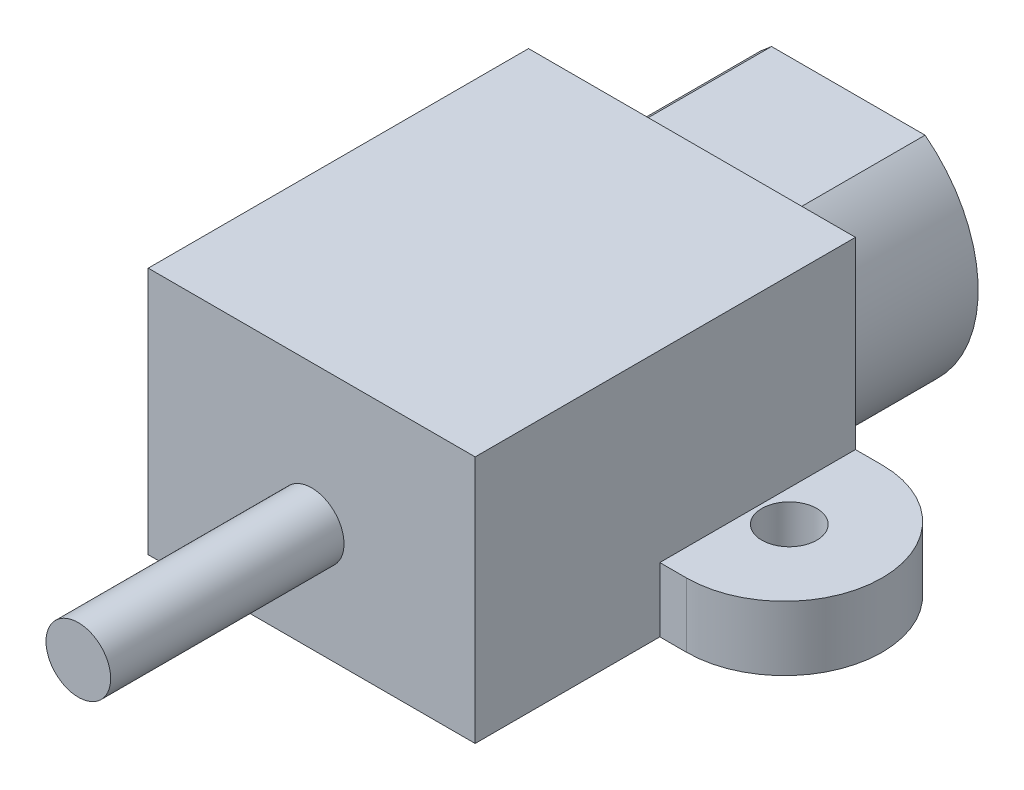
SolidWorks part; units mm, degrees
ref_plane "Front Plane" through (0, 0, 0) normal (0, 0, 1) x (1, 0, 0)
ref_plane "Top Plane" through (0, 0, 0) normal (0, 1, 0) x (1, 0, 0)
ref_plane "Right Plane" through (0, 0, 0) normal (1, 0, 0) x (0, 0, -1)
sketch "Sketch1" plane through (0, 0, 0) normal (0, 1, 0) x (1, 0, 0)
  line L0 (-1.2319, 8.5217) -> (16.3195, 8.5217) construction
  line L1 (0, 0) -> (15.0876, 0)
  line L2 (15.0876, 0) -> (15.0876, 8.5217)
  line L3 (-1.2319, 17.5514) -> (16.3195, 17.5514)
  line L4 (0, 0) -> (0, 8.5217)
  line L5 (16.3195, 8.5217) -> (15.0876, 8.5217)
  line L6 (0, 8.5217) -> (-1.2319, 8.5217)
  arc A0 (-1.2319, 17.5514) -> (-1.2319, 8.5217) centre (-1.2319, 13.0365) ccw
  arc A1 (16.3195, 17.5514) -> (16.3195, 8.5217) centre (16.3195, 13.0365) cw
  point P13 (20.8344, 13.0365)
  point P14 (-5.7468, 13.0365)
  point P17 (7.5438, 0)
  point P18 (7.5438, 8.5217)
  dimension "D1" = 17.5514
  dimension "D2" = 9.0297
  dimension "D3" = 26.5811
  dimension "D4" = 15.0876
extrude "Boss-Extrude1" add sketch "Sketch1" along normal blind 2.9718
sketch "Sketch2" plane through (0, 2.9718, 0) normal (0, 1, 0) x (1, 0, 0)
  line L0 (15.0876, 0) -> (15.0876, 8.5217) construction
  line L1 (0, 0) -> (15.0876, 0)
  line L2 (0, 0) -> (0, 17.5514)
  line L3 (0, 17.5514) -> (15.0876, 17.5514)
  line L4 (15.0876, 0) -> (15.0876, 17.5514)
  line L5 (16.3195, 17.5514) -> (-1.2319, 17.5514) construction
  point P6 (14.5462, 14.5462)
extrude "Boss-Extrude2" add sketch "Sketch2" along normal offset from surface (8.4836 mm away) 11.4554
sketch "Sketch3" plane through (0, 0, -17.5514) normal (0, 0, -1) x (-1, 0, 0)
  line L1 (-16.3195, 0) -> (1.2319, 0) construction
  line L2 (-13.4874, 0) -> (-1.6002, 0) construction
  line L3 (-13.4874, 0) -> (-13.4874, 9.906) construction
  line L4 (-13.4874, 9.906) -> (-1.6002, 9.906) construction
  line L5 (-1.6002, 0) -> (-1.6002, 9.906) construction
  line L6 (-13.4874, 0) -> (-1.6002, 9.906) construction
  line L7 (-13.4874, 9.906) -> (-1.6002, 0) construction
  circle A0 centre (-7.5438, 4.953) radius 1.4922
  point P2 (-7.5438, 6.4453)
  point P7 (-7.5438, 4.953)
  point P8 (-7.5438, 0)
  point P11 (0, 0)
  dimension "D3" = 2.9845
  dimension "D1" = 9.906
  dimension "D2" = 11.8872
extrude "Boss-Extrude3" add sketch "Sketch3" against normal offset from surface (28.321 mm away) 10.7696
sketch "Sketch4" plane through (0, 0, 0) normal (0, -1, 0) x (1, 0, 0)
  line L0 (17.8181, -13.0365) -> (-2.7305, -13.0365) construction
  line L1 (16.3195, -17.5514) -> (-1.2319, -17.5514) construction
  circle A0 centre (16.5481, -13.0365) radius 1.27
  circle A1 centre (-1.4605, -13.0365) radius 1.27
  arc A4 (16.3195, -17.5514) -> (16.3195, -8.5217) centre (16.3195, -13.0365) ccw construction
  point P6 (7.5438, -13.0365)
  point P9 (7.5438, -17.5514)
  point P13 (20.8344, -13.0365)
  dimension "D1" = 2.54
  dimension "D2" = 20.5486
extrude "Cut-Extrude1" cut sketch "Sketch4" against normal through all
sketch "Sketch5" plane through (0, 0, -17.5514) normal (0, 0, -1) x (-1, 0, 0)
  line L0 (-16.3195, 0) -> (1.2319, 0) construction
  line L1 (-11.0871, 9.9314) -> (-4.0005, 9.9314)
  line L2 (-4.0005, 0) -> (-11.0871, 0)
  line L3 (-13.5382, 4.9657) -> (-1.5494, 4.9657) construction
  line L4 (-11.0871, 9.9314) -> (-13.5382, 9.9314) construction
  line L5 (-13.5382, 9.9314) -> (-13.5382, 4.9657) construction
  line L6 (-1.5494, 4.9657) -> (-1.5494, 9.9314) construction
  line L7 (-1.5494, 9.9314) -> (-4.0005, 9.9314) construction
  line L8 (-4.0005, 9.9314) -> (-3.9689, 9.9242) construction
  line L9 (-13.5382, 4.9657) -> (-13.5382, 0) construction
  line L10 (-13.5382, 0) -> (-11.0871, 0) construction
  line L11 (-11.0871, 0) -> (-11.1199, -0.0263) construction
  line L12 (-4.0005, 0) -> (-1.5494, 0) construction
  line L13 (-1.5494, 0) -> (-1.5494, 4.9657) construction
  arc A0 (-11.0871, 0) -> (-11.0871, 9.9314) centre (-7.2826, 4.9657) cw
  arc A1 (-4.0005, 9.9314) -> (-4.0005, 0) centre (-7.805, 4.9657) cw
  point P13 (-7.5438, 0)
  dimension "D1" = 9.9314
  dimension "D2" = 11.9888
  dimension "D3" = 7.0866
extrude "Boss-Extrude4" add sketch "Sketch5" along normal blind 7.2136
